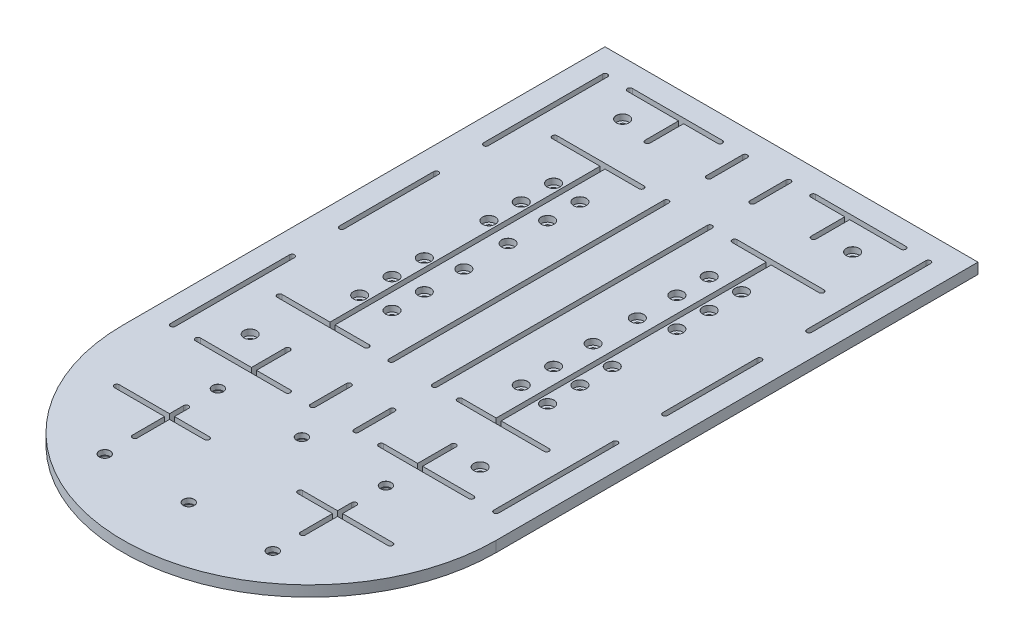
SolidWorks part; units mm, degrees
ref_plane "Front Plane" through (0, 0, 0) normal (0, 0, 1) x (1, 0, 0)
ref_plane "Top Plane" through (0, 0, 0) normal (0, 1, 0) x (1, 0, 0)
ref_plane "Right Plane" through (0, 0, 0) normal (1, 0, 0) x (0, 0, -1)
sketch "Sketch1" plane through (0, 0, 0) normal (0, 1, 0) x (1, 0, 0)
  line L0 (0, 123.0312) -> (0, -123.0312) construction
  line L2 (-95.25, -123.0312) -> (-95.25, 123.0312)
  line L3 (-95.25, 123.0312) -> (95.25, 123.0312)
  line L4 (95.25, -123.0312) -> (95.25, 123.0312)
  line L5 (-95.25, 0) -> (95.25, 0) construction
  line L6 (-95.25, -123.0312) -> (95.25, -123.0312) construction
  arc A0 (95.25, -123.0312) -> (-95.25, -123.0312) centre (0, -123.0312) cw
  point P0 (0, 0)
  point P11 (0, -123.0312)
  dimension "D1" = 246.0625
  dimension "D2" = 190.5
extrude "Boss-Extrude1" add sketch "Sketch1" along normal blind 5.461
sketch "Sketch4" plane through (0, 5.461, 0) normal (0, 1, 0) x (1, 0, 0)
  line L0 (0, 123.0312) -> (0, 0) construction
  line L1 (95.25, 123.0312) -> (-95.25, 123.0312) construction
  line L2 (0, 0) -> (-95.25, 0) construction
  line L3 (-95.25, 123.0312) -> (-95.25, -123.0312) construction
  line L4 (-95.25, -123.0313) -> (0, -123.0312) construction
  line L5 (-58.7375, 95.5358) -> (-58.7375, 73.3107) construction
  line L6 (-58.7375, 73.3107) -> (0, 73.3107) construction
  circle A0 centre (-46.0375, 76.4858) radius 3.937 construction
  circle A1 centre (-58.7375, 95.5358) radius 1.905
  circle A3 centre (-46.0375, -75.6476) radius 2.54 construction
  circle A4 centre (-58.7375, -94.6976) radius 1.905
  circle A5 centre (58.7375, -94.6976) radius 1.905
  circle A6 centre (58.7375, 95.5358) radius 1.905
  dimension "D3" = 19.05
  dimension "D5" = 47.3837
  dimension "D7" = 19.05
  dimension "D9" = 3.81
  dimension "D10" = 3.81
  dimension "D1" = 46.0375
  dimension "D2" = 46.5455
  dimension "D4" = 12.7
  dimension "D6" = 46.0375
  dimension "D8" = 12.7
sketch "Sketch2" plane through (0, 5.461, 0) normal (0, 1, 0) x (1, 0, 0)
  line L0 (0, 0) -> (0, 123.0312) construction
  line L1 (-41.16, -68.9412) -> (-23.8049, -68.9412)
  line L2 (-95.25, 0) -> (0, 0) construction
  line L3 (95.25, 123.0312) -> (-95.25, 123.0312) construction
  line L4 (-41.16, -71.4812) -> (-23.8049, -71.4812)
  line L5 (-11.1049, 110.3312) -> (-11.1049, 91.9355) construction
  line L6 (-82.55, 110.3312) -> (-82.55, 49.4779) construction
  line L7 (-69.85, 110.3312) -> (-23.8049, 110.3312) construction
  line L8 (-68.1547, 70.2112) -> (-23.8049, 70.2112) construction
  line L10 (-82.55, 0) -> (-82.55, 24.0779) construction
  line L11 (-11.1049, 70.2112) -> (-11.1049, 0) construction
  line L16 (-95.25, 123.0312) -> (-95.25, -123.0312) construction
  line L17 (-82.55, 110.3312) -> (-82.55, 49.4779) construction
  line L18 (-81.28, 110.3312) -> (-81.28, 49.4779)
  line L19 (-83.82, 110.3312) -> (-83.82, 49.4779)
  line L20 (-69.85, 110.3312) -> (-23.8049, 110.3312) construction
  line L21 (-69.85, 111.6012) -> (-23.8049, 111.6012)
  line L22 (-69.85, 109.0613) -> (-43.7, 109.0612)
  line L23 (-11.1049, 91.9355) -> (-11.1049, 110.3312) construction
  line L24 (-12.3749, 91.9355) -> (-12.3749, 110.3312)
  line L25 (-9.8349, 91.9355) -> (-9.8349, 110.3312)
  line L26 (-68.1547, 70.2112) -> (-23.8049, 70.2112) construction
  line L27 (-68.1547, 71.4812) -> (-43.7, 71.4812)
  line L28 (-68.1547, 68.9412) -> (-43.7, 68.9412)
  line L32 (-82.55, 0) -> (-82.55, 24.0779) construction
  line L33 (-83.82, -24.0779) -> (-83.82, 24.0779)
  line L34 (-81.28, -24.0779) -> (-81.28, 24.0779)
  line L35 (-11.1049, 70.2112) -> (-11.1049, 0) construction
  line L36 (-9.8349, 70.2112) -> (-9.8349, -70.2112)
  line L37 (-12.3749, 70.2112) -> (-12.3749, -70.2112)
  line L38 (-41.16, 71.4812) -> (-23.8049, 71.4812)
  line L39 (-43.7, 68.9412) -> (-43.7, -68.9412)
  line L40 (-41.16, 68.9412) -> (-23.8049, 68.9412)
  line L41 (-41.16, 68.9412) -> (-41.16, -68.9412)
  line L42 (-68.1547, -68.9412) -> (-43.7, -68.9412)
  line L43 (-68.1547, -71.4812) -> (-43.7, -71.4812)
  line L46 (-11.1049, -91.9355) -> (-11.1049, -110.3312) construction
  line L47 (-12.3749, -91.9355) -> (-12.3749, -110.3312)
  line L48 (-9.8349, -91.9355) -> (-9.8349, -110.3312)
  line L49 (-69.85, -110.3312) -> (-23.8049, -110.3312) construction
  line L50 (-69.85, -111.6012) -> (-23.8049, -111.6012)
  line L51 (-69.85, -109.0613) -> (-43.7, -109.0612)
  line L52 (-82.55, -110.3312) -> (-82.55, -49.4779) construction
  line L53 (-81.28, -110.3312) -> (-81.28, -49.4779)
  line L54 (-83.82, -110.3312) -> (-83.82, -49.4779)
  line L55 (69.85, 110.3312) -> (23.8049, 110.3312) construction
  line L56 (69.85, 111.6012) -> (23.8049, 111.6012)
  line L57 (69.85, 109.0613) -> (43.7, 109.0612)
  line L58 (11.1049, 91.9355) -> (11.1049, 110.3312) construction
  line L59 (12.3749, 91.9355) -> (12.3749, 110.3312)
  line L60 (9.8349, 91.9355) -> (9.8349, 110.3312)
  line L61 (41.16, 68.9412) -> (23.8049, 68.9412)
  line L62 (41.16, 71.4812) -> (23.8049, 71.4812)
  line L65 (68.1547, 71.4812) -> (43.7, 71.4812)
  line L66 (68.1547, 68.9412) -> (43.7, 68.9412)
  line L67 (82.55, 110.3312) -> (82.55, 49.4779) construction
  line L68 (81.28, 110.3312) -> (81.28, 49.4779)
  line L69 (83.82, 110.3312) -> (83.82, 49.4779)
  line L70 (12.3749, 70.2112) -> (12.3749, -70.2112)
  line L71 (9.8349, 70.2112) -> (9.8349, -70.2112)
  line L72 (81.28, -24.0779) -> (81.28, 24.0779)
  line L73 (83.82, -24.0779) -> (83.82, 24.0779)
  line L74 (41.16, 68.9412) -> (41.16, -68.9412)
  line L75 (43.7, 68.9412) -> (43.7, -68.9412)
  line L76 (11.1049, -91.9355) -> (11.1049, -110.3312) construction
  line L77 (12.3749, -91.9355) -> (12.3749, -110.3312)
  line L78 (9.8349, -91.9355) -> (9.8349, -110.3312)
  line L81 (68.1547, -71.4812) -> (43.7, -71.4812)
  line L82 (68.1547, -68.9412) -> (43.7, -68.9412)
  line L83 (41.16, -71.4812) -> (23.8049, -71.4812)
  line L84 (41.16, -68.9412) -> (23.8049, -68.9412)
  line L85 (82.55, -110.3312) -> (82.55, -49.4779) construction
  line L86 (81.28, -110.3312) -> (81.28, -49.4779)
  line L87 (83.82, -110.3312) -> (83.82, -49.4779)
  line L88 (69.85, -110.3312) -> (23.8049, -110.3312) construction
  line L89 (69.85, -111.6012) -> (23.8049, -111.6012)
  line L90 (69.85, -109.0613) -> (43.7, -109.0612)
  line L91 (-42.43, 70.2112) -> (-42.43, 0) construction
  line L92 (-42.43, 70.2112) -> (-42.43, 0) construction
  line L94 (-42.43, 70.2112) -> (-42.43, 110.3312) construction
  line L95 (-42.43, 91.9355) -> (-42.43, 117.9513) construction
  line L96 (-43.7, 91.9355) -> (-43.7, 109.0612)
  line L97 (-41.16, 91.9355) -> (-41.16, 109.0612)
  line L98 (-41.16, 109.0612) -> (-23.8049, 109.0613)
  line L100 (-43.7, -71.4812) -> (-41.16, -71.4812)
  line L101 (41.16, -71.4812) -> (43.7, -71.4812)
  line L102 (41.16, 71.4812) -> (43.7, 71.4812)
  line L103 (43.7, 91.9355) -> (43.7, 109.0612)
  line L104 (41.16, 91.9355) -> (41.16, 109.0612)
  line L105 (-41.16, 71.4812) -> (-43.7, 71.4812)
  line L106 (41.16, 109.0612) -> (23.8049, 109.0613)
  line L107 (41.16, -91.9355) -> (41.16, -109.0612)
  line L108 (43.7, -91.9355) -> (43.7, -109.0612)
  line L109 (-41.16, -91.9355) -> (-41.16, -109.0612)
  line L110 (-43.7, -91.9355) -> (-43.7, -109.0612)
  line L111 (-41.16, -109.0612) -> (-23.8049, -109.0613)
  line L112 (41.16, -109.0612) -> (23.8049, -109.0613)
  arc A0 (-81.28, 110.3312) -> (-83.82, 110.3312) centre (-82.55, 110.3312) ccw
  arc A1 (-83.82, 49.4779) -> (-81.28, 49.4779) centre (-82.55, 49.4779) ccw
  arc A2 (-69.85, 111.6012) -> (-69.85, 109.0613) centre (-69.85, 110.3312) ccw
  arc A3 (-23.8049, 109.0613) -> (-23.8049, 111.6012) centre (-23.8049, 110.3312) ccw
  arc A4 (-12.3749, 91.9355) -> (-9.8349, 91.9355) centre (-11.1049, 91.9355) ccw
  arc A5 (-9.8349, 110.3312) -> (-12.3749, 110.3312) centre (-11.1049, 110.3312) ccw
  arc A6 (-68.1547, 71.4812) -> (-68.1547, 68.9412) centre (-68.1547, 70.2112) ccw
  arc A7 (-23.8049, 68.9412) -> (-23.8049, 71.4812) centre (-23.8049, 70.2112) ccw
  arc A11 (-81.28, 24.0779) -> (-83.82, 24.0779) centre (-82.55, 24.0779) ccw
  arc A12 (-9.8349, 70.2112) -> (-12.3749, 70.2112) centre (-11.1049, 70.2112) ccw
  arc A13 (-81.28, -24.0779) -> (-83.82, -24.0779) centre (-82.55, -24.0779) cw
  arc A14 (-9.8349, -70.2112) -> (-12.3749, -70.2112) centre (-11.1049, -70.2112) cw
  arc A15 (-23.8049, -68.9412) -> (-23.8049, -71.4812) centre (-23.8049, -70.2112) cw
  arc A16 (-68.1547, -71.4812) -> (-68.1547, -68.9412) centre (-68.1547, -70.2112) cw
  arc A18 (-12.3749, -91.9355) -> (-9.8349, -91.9355) centre (-11.1049, -91.9355) cw
  arc A19 (-9.8349, -110.3312) -> (-12.3749, -110.3312) centre (-11.1049, -110.3312) cw
  arc A20 (-69.85, -111.6012) -> (-69.85, -109.0613) centre (-69.85, -110.3312) cw
  arc A21 (-23.8049, -109.0613) -> (-23.8049, -111.6012) centre (-23.8049, -110.3312) cw
  arc A22 (-81.28, -110.3312) -> (-83.82, -110.3312) centre (-82.55, -110.3312) cw
  arc A23 (-83.82, -49.4779) -> (-81.28, -49.4779) centre (-82.55, -49.4779) cw
  arc A24 (69.85, 111.6012) -> (69.85, 109.0613) centre (69.85, 110.3312) cw
  arc A25 (23.8049, 109.0613) -> (23.8049, 111.6012) centre (23.8049, 110.3312) cw
  arc A26 (12.3749, 91.9355) -> (9.8349, 91.9355) centre (11.1049, 91.9355) cw
  arc A27 (9.8349, 110.3312) -> (12.3749, 110.3312) centre (11.1049, 110.3312) cw
  arc A29 (23.8049, 68.9412) -> (23.8049, 71.4812) centre (23.8049, 70.2112) cw
  arc A30 (68.1547, 71.4812) -> (68.1547, 68.9412) centre (68.1547, 70.2112) cw
  arc A31 (81.28, 110.3312) -> (83.82, 110.3312) centre (82.55, 110.3312) cw
  arc A32 (83.82, 49.4779) -> (81.28, 49.4779) centre (82.55, 49.4779) cw
  arc A33 (81.28, 24.0779) -> (83.82, 24.0779) centre (82.55, 24.0779) cw
  arc A34 (81.28, -24.0779) -> (83.82, -24.0779) centre (82.55, -24.0779) ccw
  arc A35 (9.8349, 70.2112) -> (12.3749, 70.2112) centre (11.1049, 70.2112) cw
  arc A36 (9.8349, -70.2112) -> (12.3749, -70.2112) centre (11.1049, -70.2112) ccw
  arc A37 (12.3749, -91.9355) -> (9.8349, -91.9355) centre (11.1049, -91.9355) ccw
  arc A38 (9.8349, -110.3312) -> (12.3749, -110.3312) centre (11.1049, -110.3312) ccw
  arc A40 (68.1547, -71.4812) -> (68.1547, -68.9412) centre (68.1547, -70.2112) ccw
  arc A41 (23.8049, -68.9412) -> (23.8049, -71.4812) centre (23.8049, -70.2112) ccw
  arc A42 (81.28, -110.3312) -> (83.82, -110.3312) centre (82.55, -110.3312) ccw
  arc A43 (83.82, -49.4779) -> (81.28, -49.4779) centre (82.55, -49.4779) ccw
  arc A44 (69.85, -111.6012) -> (69.85, -109.0613) centre (69.85, -110.3312) ccw
  arc A45 (23.8049, -109.0613) -> (23.8049, -111.6012) centre (23.8049, -110.3312) ccw
  arc A46 (-43.7, 91.9355) -> (-41.16, 91.9355) centre (-42.43, 91.9355) ccw
  arc A48 (43.7, 91.9355) -> (41.16, 91.9355) centre (42.43, 91.9355) cw
  arc A49 (43.7, -91.9355) -> (41.16, -91.9355) centre (42.43, -91.9355) ccw
  arc A50 (-43.7, -91.9355) -> (-41.16, -91.9355) centre (-42.43, -91.9355) cw
  point P5 (-81.28, 0)
  point P8 (-83.82, 0)
  point P11 (-9.8349, 0)
  point P13 (-12.3749, 0)
  point P14 (0, -123.0312)
  point P31 (-82.55, 79.9046)
  point P36 (-46.8274, 110.3312)
  point P41 (-11.1049, 101.1334)
  point P46 (-45.9798, 70.2112)
  point P51 (-42.43, 48.8156)
  point P56 (-82.55, 12.039)
  point P59 (-41.16, 0)
  point P61 (-11.1049, 12.039)
  point P63 (-43.7, 0)
  point P82 (-11.1049, -101.1334)
  point P89 (-46.8274, -110.3312)
  point P96 (-82.55, -79.9046)
  point P103 (46.8274, 110.3312)
  point P110 (11.1049, 101.1334)
  point P130 (82.55, 79.9046)
  point P151 (11.1049, -101.1334)
  point P169 (82.55, -79.9046)
  point P176 (46.8274, -110.3312)
  point P181 (-42.43, 96.0534)
  point P193 (0, 0)
  dimension "D9" = 12.7
  dimension "D4" = 17.1257
  dimension "D1" = 11.1049
  dimension "D2" = 25.4
  dimension "D3" = 40.12
  dimension "D5" = 60.8533
  dimension "D6" = 12.7
  dimension "D7" = 12.7
  dimension "D8" = 12.7
  dimension "D10" = 18.3957
extrude "Cut-Extrude1" cut sketch "Sketch2" against normal through all
sketch "Sketch3" plane through (0, 5.461, 0) normal (0, 1, 0) x (1, 0, 0)
  line L1 (-44.1769, -152.9913) -> (-44.1769, -169.4425)
  line L2 (-44.177, -143.2805) -> (-44.1769, -150.4513)
  line L9 (-41.6369, -143.2805) -> (-41.6369, -150.4513)
  line L10 (41.6369, -143.2805) -> (41.6369, -150.4513)
  line L11 (44.1769, -143.2805) -> (44.1769, -150.4513)
  line L12 (-41.6369, -152.9913) -> (-41.6369, -169.4425)
  line L13 (-69.85, -150.4513) -> (-44.1769, -150.4513)
  line L14 (-69.85, -152.9913) -> (-44.1769, -152.9913)
  line L15 (83.82, 49.4779) -> (83.82, 110.3312) construction
  line L16 (-41.6369, -150.4513) -> (-23.8049, -150.4513)
  line L17 (23.8049, -150.4513) -> (41.6369, -150.4513)
  line L18 (23.8049, -152.9913) -> (41.6369, -152.9913)
  line L19 (-41.6369, -152.9913) -> (-23.8049, -152.9913)
  line L20 (0, -127.0194) -> (0, -184.7917) construction
  line L21 (44.1769, -150.4513) -> (69.85, -150.4513)
  line L22 (-42.907, -127.0194) -> (42.907, -127.0194) construction
  line L23 (44.1769, -152.9913) -> (69.85, -152.9913)
  line L24 (41.6369, -152.9913) -> (41.637, -169.4425)
  line L25 (44.1769, -152.9913) -> (44.177, -169.4425)
  line L26 (-42.907, -184.7917) -> (42.907, -184.7917) construction
  circle A13 centre (-42.907, -127.0194) radius 2.3432
  circle A16 centre (0, -127.0194) radius 2.3431
  circle A17 centre (42.907, -127.0194) radius 2.3432
  circle A18 centre (-42.907, -184.7917) radius 2.3432
  arc A20 (-69.85, -150.4513) -> (-69.85, -152.9913) centre (-69.85, -151.7213) ccw
  arc A21 (-23.8049, -152.9913) -> (-23.8049, -150.4513) centre (-23.8049, -151.7213) ccw
  circle A22 centre (0, -184.7917) radius 2.3431
  arc A23 (23.8049, -150.4513) -> (23.8049, -152.9913) centre (23.8049, -151.7213) ccw
  arc A24 (69.85, -152.9913) -> (69.85, -150.4513) centre (69.85, -151.7213) ccw
  arc A36 (-41.6369, -143.2805) -> (-44.177, -143.2805) centre (-42.907, -143.2805) ccw
  arc A37 (-44.1769, -169.4425) -> (-41.6369, -169.4425) centre (-42.907, -169.4425) ccw
  arc A38 (44.1769, -143.2805) -> (41.6369, -143.2805) centre (42.907, -143.2805) ccw
  arc A40 (41.637, -169.4425) -> (44.177, -169.4425) centre (42.907, -169.4425) ccw
  circle A43 centre (42.907, -184.7917) radius 2.3432
  point P14 (-42.907, -142.0105)
  dimension "D1" = 85.8139
  dimension "D3" = 14.9911
  dimension "D2" = 57.7723
extrude "Cut-Extrude2" cut sketch "Sketch3" against normal through all
sketch "Sketch5" plane through (0, 5.461, 0) normal (0, 1, 0) x (1, 0, 0)
  line L0 (0, 0) -> (0, 123.0312) construction
  line L1 (95.25, 123.0312) -> (-95.25, 123.0312) construction
  line L2 (0, 0) -> (-95.25, 0) construction
  line L3 (-95.25, 123.0312) -> (-95.25, -123.0312) construction
  line L4 (-33.0073, 47.9933) -> (-33.0073, 0) construction
  line L5 (-47.9933, 33.0073) -> (-47.9933, 0) construction
  circle A0 centre (-33.0073, 47.9933) radius 1.905
  circle A1 centre (-47.9933, 33.0073) radius 1.905
  circle A2 centre (-47.9933, 16.5036) radius 1.905
  circle A3 centre (-47.9933, 49.511) radius 1.905
  circle A4 centre (-33.0073, 31.4896) radius 1.905
  circle A7 centre (-33.0073, 11.2913) radius 1.905
  circle A8 centre (33.0073, 11.2913) radius 1.905
  circle A9 centre (33.0073, 31.4896) radius 1.905
  circle A10 centre (47.9933, 16.5036) radius 1.905
  circle A11 centre (47.9933, 33.0073) radius 1.905
  circle A12 centre (47.9933, 49.511) radius 1.905
  circle A13 centre (33.0073, 47.9933) radius 1.905
  circle A14 centre (47.9933, -16.5036) radius 1.905
  circle A15 centre (33.0073, -11.2913) radius 1.905
  circle A16 centre (33.0073, -31.4896) radius 1.905
  circle A17 centre (47.9933, -33.0073) radius 1.905
  circle A18 centre (47.9933, -49.511) radius 1.905
  circle A19 centre (33.0073, -47.9933) radius 1.905
  circle A20 centre (-33.0073, -11.2913) radius 1.905
  circle A21 centre (-47.9933, -16.5036) radius 1.905
  circle A22 centre (-33.0073, -31.4896) radius 1.905
  circle A23 centre (-47.9933, -33.0073) radius 1.905
  circle A24 centre (-33.0073, -47.9933) radius 1.905
  circle A25 centre (-47.9933, -49.511) radius 1.905
  point P19 (-47.9933, 33.0073)
  point P25 (-42.43, 56.4907)
  point P28 (-33.0073, 31.1265)
  dimension "D3" = 47.9933
  dimension "D5" = 3.81
  dimension "D6" = 16.5037
  dimension "D1" = 47.9933
  dimension "D2" = 33.0073
  dimension "D4" = 33.0073
  dimension "D7" = 16.5037
hole_wizard "CBORE for M3 SHCS1" positions "3DSketch1" profile "Sketch8" counterbore size "M3" standard "ANSI Metric"
sketch3d "3DSketch1"
  point P0 (-47.9933, 5.461, -49.511)
  point P3 (-33.0073, 5.461, -47.9933)
  point P6 (-33.0073, 5.461, -31.4896)
  point P9 (-47.9933, 5.461, -33.0073)
  point P12 (-47.9933, 5.461, -16.5036)
  point P15 (-33.0073, 5.461, -11.2913)
  point P18 (33.0073, 5.461, -47.9933)
  point P21 (47.9933, 5.461, -49.511)
  point P24 (47.9933, 5.461, -33.0073)
  point P27 (33.0073, 5.461, -31.4896)
  point P30 (33.0073, 5.461, -11.2913)
  point P33 (47.9933, 5.461, -16.5036)
  point P36 (33.0073, 5.461, 11.2913)
  point P39 (47.9933, 5.461, 16.5036)
  point P42 (33.0073, 5.461, 31.4896)
  point P45 (47.9933, 5.461, 33.0073)
  point P48 (47.9933, 5.461, 49.511)
  point P51 (33.0073, 5.461, 47.9933)
  point P54 (-33.0073, 5.461, 11.2913)
  point P57 (-47.9933, 5.461, 16.5036)
  point P60 (-47.9933, 5.461, 33.0073)
  point P62 (-33.0073, 5.461, 31.4896)
  point P65 (-33.0073, 5.461, 47.9933)
  point P68 (-47.9933, 5.461, 49.511)
sketch "Sketch8" plane through (-47.9933, 5.461, -49.511) normal (1, 0, 0) x (0, 0, 1)
  line L0 (0, 0) -> (0, 5.461)
  line L1 (0, 5.461) -> (1.7, 5.461)
  line L3 (1.7, 5.461) -> (1.7, 3)
  line L4 (3.25, 3) -> (1.7, 3)
  line L5 (3.25, 3) -> (3.25, 0.025)
  line L6 (3.25, 0.025) -> (3.275, 0)
  line L7 (3.275, 0) -> (0, 0)
  line L8 (-3.25, 0.025) -> (-3.275, 0) construction
  line L11 (0, -6.35) -> (0, 107.95) construction
  dimension "Thru Hole Dia." = 3.4
  dimension "Thru Hole Depth" = 5.461
  dimension "C'Bore Dia." = 6.5
  dimension "C'Bore Depth" = 3
  dimension "Near C'Sink Dia." = 6.55
  dimension "Near C'Sink Angle" = 90
hole_wizard "CBORE for M3 SHCS2" positions "3DSketch2" profile "Sketch9" counterbore size "M3" standard "ANSI Metric"
sketch3d "3DSketch2"
  point P0 (-58.7375, 5.461, -95.5358)
  point P3 (58.7375, 5.461, -95.5358)
  point P6 (58.7375, 5.461, 94.6976)
  point P9 (-58.7375, 5.461, 94.6976)
sketch "Sketch9" plane through (-58.7375, 5.461, -95.5358) normal (1, 0, 0) x (0, 0, 1)
  line L0 (0, 0) -> (0, 5.461)
  line L1 (0, 5.461) -> (1.7, 5.461)
  line L3 (1.7, 5.461) -> (1.7, 3)
  line L4 (3.25, 3) -> (1.7, 3)
  line L5 (3.25, 3) -> (3.25, 0.025)
  line L6 (3.25, 0.025) -> (3.275, 0)
  line L7 (3.275, 0) -> (0, 0)
  line L8 (-3.25, 0.025) -> (-3.275, 0) construction
  line L11 (0, -6.35) -> (0, 107.95) construction
  dimension "Thru Hole Dia." = 3.4
  dimension "Thru Hole Depth" = 5.461
  dimension "C'Bore Dia." = 6.5
  dimension "C'Bore Depth" = 3
  dimension "Near C'Sink Dia." = 6.55
  dimension "Near C'Sink Angle" = 90
hole_wizard "CBORE for M2.5 SHCS1" positions "3DSketch3" profile "Sketch10" counterbore size "M2.5" standard "ANSI Metric"
sketch3d "3DSketch3"
  line L0 (-42.907, 0, 184.7917) -> (-42.907, 5.461, 184.7917) construction
  line L1 (0, 0, 184.7917) -> (0, 5.461, 184.7917) construction
  line L2 (42.907, 0, 184.7917) -> (42.907, 5.461, 184.7917) construction
  line L3 (42.907, 0, 127.0194) -> (42.907, 5.461, 127.0194) construction
  line L4 (0, 0, 127.0194) -> (0, 5.461, 127.0194) construction
  line L5 (-42.907, 0, 127.0194) -> (-42.907, 5.461, 127.0194) construction
  point P0 (-42.907, 5.461, 184.7917)
  point P4 (0, 5.461, 184.7917)
  point P8 (42.907, 5.461, 184.7917)
  point P12 (42.907, 5.461, 127.0194)
  point P16 (0, 5.461, 127.0194)
  point P20 (-42.907, 5.461, 127.0194)
sketch "Sketch10" plane through (-42.907, 5.461, 184.7917) normal (1, 0, 0) x (0, 0, 1)
  line L0 (0, 0) -> (0, 5.461)
  line L1 (0, 5.461) -> (1.45, 5.461)
  line L3 (1.45, 5.461) -> (1.45, 2.5)
  line L4 (2.75, 2.5) -> (1.45, 2.5)
  line L5 (2.75, 2.5) -> (2.75, 0.025)
  line L6 (2.75, 0.025) -> (2.775, 0)
  line L7 (2.775, 0) -> (0, 0)
  line L8 (-2.75, 0.025) -> (-2.775, 0) construction
  line L11 (0, -6.35) -> (0, 107.95) construction
  dimension "Thru Hole Dia." = 2.9
  dimension "Thru Hole Depth" = 5.461
  dimension "C'Bore Dia." = 5.5
  dimension "C'Bore Depth" = 2.5
  dimension "Near C'Sink Dia." = 5.55
  dimension "Near C'Sink Angle" = 90
